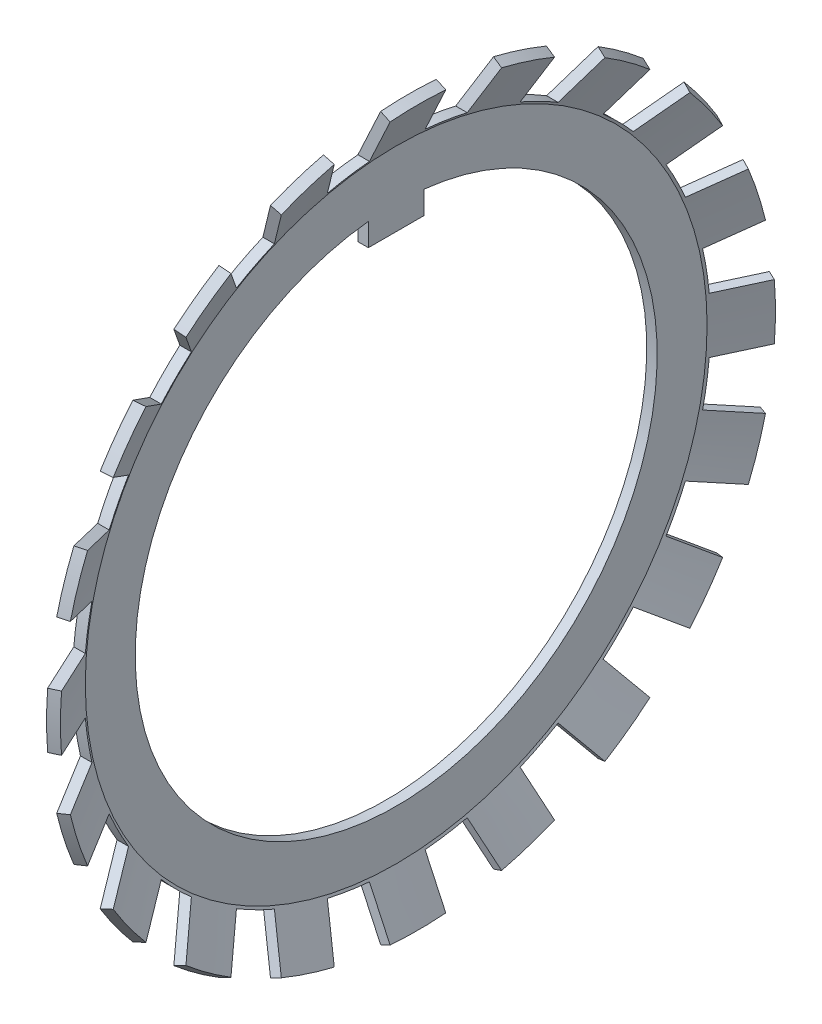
SolidWorks part; units mm, degrees
ref_plane "Plan de face" through (0, 0, 0) normal (0, 0, 1) x (1, 0, 0)
ref_plane "Plan de dessus" through (0, 0, 0) normal (0, 1, 0) x (1, 0, 0)
ref_plane "Plan de droite" through (0, 0, 0) normal (1, 0, 0) x (0, 0, -1)
sketch "Esquisse1" plane through (0, 0, 0) normal (0, 0, 1) x (1, 0, 0)
  line L0 (0, 0) -> (0, 45)
  line L1 (0, 45) -> (3.2642, 52)
  line L2 (3.2642, 52) -> (4.6236, 51.3661)
  line L3 (4.6236, 51.3661) -> (1.5, 44.6675)
  line L4 (1.5, 44.6675) -> (1.5, 0)
  line L5 (1.5, 0) -> (0, 0)
  line L6 (1.5, 0) -> (0, 0) construction
revolve "Révolution1" add sketch "Esquisse1" angle 360 about L6
sketch "Esquisse2" plane through (0, 0, 0) normal (1, 0, 0) x (0, 0, -1)
  line L0 (4, 37.2861) -> (4, 34)
  line L1 (4, 34) -> (-4, 34)
  line L2 (-4, 34) -> (-4, 37.2861)
  arc A0 (-4, 37.2861) -> (4, 37.2861) centre (0, 0) ccw
extrude "Enlèv. mat.-Extru.1" cut sketch "Esquisse2" along normal blind 1.5
sketch "Esquisse3" plane through (0, 0, 0) normal (1, 0, 0) x (0, 0, -1)
  line L0 (-114.4, 114.4) -> (-114.4, -114.4)
  line L1 (-114.4, -114.4) -> (114.4, -114.4)
  line L2 (114.4, -114.4) -> (114.4, 114.4)
  line L3 (114.4, 114.4) -> (-114.4, 114.4)
  line L4 (-51.8459, -4) -> (-44.8219, -4)
  line L5 (-43.8642, -10.0465) -> (-50.5445, -12.217)
  line L6 (-48.0723, -19.8255) -> (-41.3921, -17.6549)
  line L7 (-38.6128, -23.1096) -> (-44.2954, -27.2382)
  line L8 (-39.5931, -33.7103) -> (-33.9105, -29.5817)
  line L9 (-29.5817, -33.9105) -> (-33.7103, -39.5931)
  line L10 (-27.2382, -44.2954) -> (-23.1096, -38.6128)
  line L11 (-17.6549, -41.3921) -> (-19.8255, -48.0723)
  line L12 (-12.217, -50.5445) -> (-10.0465, -43.8642)
  line L13 (-4, -44.8219) -> (-4, -51.8459)
  line L14 (4, -51.8459) -> (4, -44.8219)
  line L15 (10.0465, -43.8642) -> (12.217, -50.5445)
  line L16 (19.8255, -48.0723) -> (17.6549, -41.3921)
  line L17 (23.1096, -38.6128) -> (27.2382, -44.2954)
  line L18 (33.7103, -39.5931) -> (29.5817, -33.9105)
  line L19 (33.9105, -29.5817) -> (39.5931, -33.7103)
  line L20 (44.2954, -27.2382) -> (38.6128, -23.1096)
  line L21 (41.3921, -17.6549) -> (48.0723, -19.8255)
  line L22 (50.5445, -12.217) -> (43.8642, -10.0465)
  line L23 (44.8219, -4) -> (51.8459, -4)
  line L24 (51.8459, 4) -> (44.8219, 4)
  line L25 (43.8642, 10.0465) -> (50.5445, 12.217)
  line L26 (48.0723, 19.8255) -> (41.3921, 17.6549)
  line L27 (38.6128, 23.1096) -> (44.2954, 27.2382)
  line L28 (39.5931, 33.7103) -> (33.9105, 29.5817)
  line L29 (29.5817, 33.9105) -> (33.7103, 39.5931)
  line L30 (27.2382, 44.2954) -> (23.1096, 38.6128)
  line L31 (17.6549, 41.3921) -> (19.8255, 48.0723)
  line L32 (12.217, 50.5445) -> (10.0465, 43.8642)
  line L33 (4, 44.8219) -> (4, 51.8459)
  line L34 (-4, 51.8459) -> (-4, 44.8219)
  line L35 (-10.0465, 43.8642) -> (-12.217, 50.5445)
  line L36 (-19.8255, 48.0723) -> (-17.6549, 41.3921)
  line L37 (-23.1096, 38.6128) -> (-27.2382, 44.2954)
  line L38 (-33.7103, 39.5931) -> (-29.5817, 33.9105)
  line L39 (-33.9105, 29.5817) -> (-39.5931, 33.7103)
  line L40 (-44.2954, 27.2382) -> (-38.6128, 23.1096)
  line L41 (-41.3921, 17.6549) -> (-48.0723, 19.8255)
  line L42 (-50.5445, 12.217) -> (-43.8642, 10.0465)
  line L43 (-44.8219, 4) -> (-51.8459, 4)
  arc A0 (-51.8459, 4) -> (-51.8459, -4) centre (0, 0) ccw
  arc A1 (-44.8219, -4) -> (-43.8642, -10.0465) centre (0, 0) ccw
  arc A2 (-50.5445, -12.217) -> (-48.0723, -19.8255) centre (0, 0) ccw
  arc A3 (-41.3921, -17.6549) -> (-38.6128, -23.1096) centre (0, 0) ccw
  arc A4 (-44.2954, -27.2382) -> (-39.5931, -33.7103) centre (0, 0) ccw
  arc A5 (-33.9105, -29.5817) -> (-29.5817, -33.9105) centre (0, 0) ccw
  arc A6 (-33.7103, -39.5931) -> (-27.2382, -44.2954) centre (0, 0) ccw
  arc A7 (-23.1096, -38.6128) -> (-17.6549, -41.3921) centre (0, 0) ccw
  arc A8 (-19.8255, -48.0723) -> (-12.217, -50.5445) centre (0, 0) ccw
  arc A9 (-10.0465, -43.8642) -> (-4, -44.8219) centre (0, 0) ccw
  arc A10 (-4, -51.8459) -> (4, -51.8459) centre (0, 0) ccw
  arc A11 (4, -44.8219) -> (10.0465, -43.8642) centre (0, 0) ccw
  arc A12 (12.217, -50.5445) -> (19.8255, -48.0723) centre (0, 0) ccw
  arc A13 (17.6549, -41.3921) -> (23.1096, -38.6128) centre (0, 0) ccw
  arc A14 (27.2382, -44.2954) -> (33.7103, -39.5931) centre (0, 0) ccw
  arc A15 (29.5817, -33.9105) -> (33.9105, -29.5817) centre (0, 0) ccw
  arc A16 (39.5931, -33.7103) -> (44.2954, -27.2382) centre (0, 0) ccw
  arc A17 (38.6128, -23.1096) -> (41.3921, -17.6549) centre (0, 0) ccw
  arc A18 (48.0723, -19.8255) -> (50.5445, -12.217) centre (0, 0) ccw
  arc A19 (43.8642, -10.0465) -> (44.8219, -4) centre (0, 0) ccw
  arc A20 (51.8459, -4) -> (51.8459, 4) centre (0, 0) ccw
  arc A21 (44.8219, 4) -> (43.8642, 10.0465) centre (0, 0) ccw
  arc A22 (50.5445, 12.217) -> (48.0723, 19.8255) centre (0, 0) ccw
  arc A23 (41.3921, 17.6549) -> (38.6128, 23.1096) centre (0, 0) ccw
  arc A24 (44.2954, 27.2382) -> (39.5931, 33.7103) centre (0, 0) ccw
  arc A25 (33.9105, 29.5817) -> (29.5817, 33.9105) centre (0, 0) ccw
  arc A26 (33.7103, 39.5931) -> (27.2382, 44.2954) centre (0, 0) ccw
  arc A27 (23.1096, 38.6128) -> (17.6549, 41.3921) centre (0, 0) ccw
  arc A28 (19.8255, 48.0723) -> (12.217, 50.5445) centre (0, 0) ccw
  arc A29 (10.0465, 43.8642) -> (4, 44.8219) centre (0, 0) ccw
  arc A30 (4, 51.8459) -> (-4, 51.8459) centre (0, 0) ccw
  arc A31 (-4, 44.8219) -> (-10.0465, 43.8642) centre (0, 0) ccw
  arc A32 (-12.217, 50.5445) -> (-19.8255, 48.0723) centre (0, 0) ccw
  arc A33 (-17.6549, 41.3921) -> (-23.1096, 38.6128) centre (0, 0) ccw
  arc A34 (-27.2382, 44.2954) -> (-33.7103, 39.5931) centre (0, 0) ccw
  arc A35 (-29.5817, 33.9105) -> (-33.9105, 29.5817) centre (0, 0) ccw
  arc A36 (-39.5931, 33.7103) -> (-44.2954, 27.2382) centre (0, 0) ccw
  arc A37 (-38.6128, 23.1096) -> (-41.3921, 17.6549) centre (0, 0) ccw
  arc A38 (-48.0723, 19.8255) -> (-50.5445, 12.217) centre (0, 0) ccw
  arc A39 (-43.8642, 10.0465) -> (-44.8219, 4) centre (0, 0) ccw
extrude "Enlèv. mat.-Extru.2" cut sketch "Esquisse3" along normal blind 71.5
